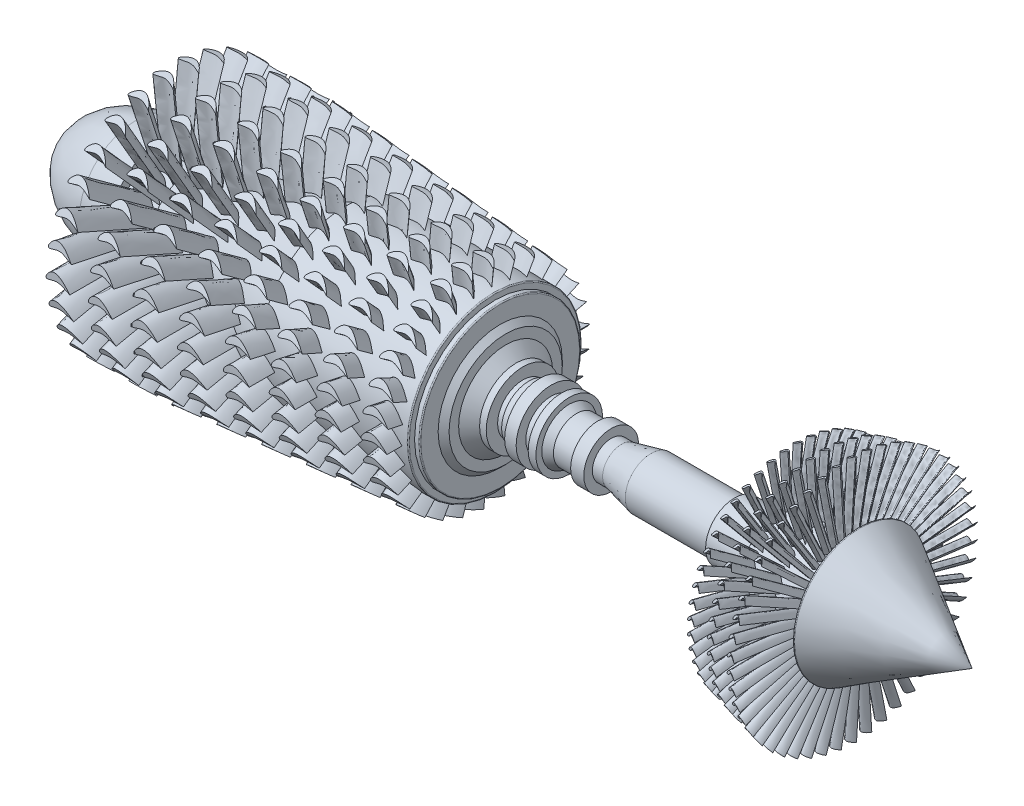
SolidWorks part; units mm, degrees
ref_plane "Front Plane" through (0, 0, 0) normal (0, 0, 1) x (1, 0, 0)
ref_plane "Top Plane" through (0, 0, 0) normal (0, 1, 0) x (1, 0, 0)
ref_plane "Right Plane" through (0, 0, 0) normal (1, 0, 0) x (0, 0, -1)
sketch "Sketch1" plane through (0, 0, 0) normal (0, 0, 1) x (1, 0, 0)
  line L0 (-311.1667, 12) -> (324.1667, 12) construction
sketch "Sketch3" plane through (0, 0, 0) normal (0, 0, 1) x (1, 0, 0)
  line L0 (-442.9556, 53.9612) -> (404.6867, 53.9612) construction
  line L1 (-442.9556, 0) -> (404.6867, 0) construction
  line L2 (-388.0448, 183.2391) -> (-243.6443, 183.2391) construction
  line L3 (-243.6443, 183.2391) -> (-129.9826, 173.946) construction
  line L4 (-129.9826, 173.946) -> (-45.3579, 163.3045) construction
  line L5 (-45.3579, 163.3045) -> (21.8151, 163.3045) construction
  line L6 (21.8151, 163.3045) -> (68.0956, 183.2391) construction
  line L7 (68.0956, 183.2391) -> (180.7178, 183.2391) construction
  line L8 (180.7178, 183.2391) -> (221.243, 163.3045) construction
  line L9 (221.243, 163.3045) -> (297.6355, 178.5926) construction
  line L10 (297.6355, 178.5926) -> (373.5398, 158.0965) construction
  line L11 (373.5398, 158.0965) -> (404.6867, 158.0965) construction
  line L12 (404.6867, 158.0965) -> (423.7959, 148.6966) construction
  line L13 (-388.0448, 183.2391) -> (-388.0448, 173.946) construction
  line L14 (-388.0448, 173.946) -> (-243.6443, 173.946) construction
  line L15 (-243.6443, 173.946) -> (-129.9826, 168.6253) construction
  line L16 (-129.9826, 168.6253) -> (-45.3579, 157.9838) construction
  line L17 (-45.3579, 157.9838) -> (21.8151, 157.9838) construction
  line L18 (21.8151, 157.9838) -> (68.0956, 177.9184) construction
  line L19 (68.0956, 177.9184) -> (180.7178, 177.9184) construction
  line L20 (180.7178, 177.9184) -> (219.1356, 159.0204) construction
  line L21 (219.1356, 159.0204) -> (297.6355, 174.7302) construction
  line L22 (297.6355, 174.7302) -> (373.5398, 154.2341) construction
  line L23 (373.5398, 154.2341) -> (404.6867, 154.2341) construction
  line L24 (404.6867, 154.2341) -> (422.2661, 145.5867) construction
  line L25 (422.2661, 145.5867) -> (423.7959, 148.6966) construction
  line L26 (404.6867, 53.9612) -> (297.6355, 116.8296)
  line L27 (297.6355, 116.8296) -> (297.6355, 104.3492)
  line L28 (297.6355, 104.3492) -> (232.7745, 104.3492)
  line L29 (232.7745, 104.3492) -> (232.7745, 92.3679)
  line L30 (232.7745, 92.3679) -> (229.2799, 92.3679)
  line L31 (229.2799, 92.3679) -> (229.2799, 81.3851)
  line L32 (229.2799, 81.3851) -> (180.7178, 81.3851)
  line L33 (180.7178, 81.3851) -> (180.7178, 78.1886)
  line L34 (180.7178, 78.1886) -> (101.7924, 78.1886)
  line L35 (101.7924, 78.1886) -> (73.814, 71.6783)
  line L36 (73.814, 71.6783) -> (64.2236, 71.6783)
  line L37 (64.2236, 71.6783) -> (64.2236, 79.7868)
  line L38 (64.2236, 79.7868) -> (51.7953, 79.7868)
  line L39 (51.7953, 79.7868) -> (51.7953, 75.7325)
  line L40 (51.7953, 75.7325) -> (31.5277, 75.7325)
  line L41 (31.5277, 75.7325) -> (24.6241, 79.7868)
  line L42 (24.6241, 79.7868) -> (24.6241, 85.3954)
  line L43 (24.6241, 85.3954) -> (17.3786, 85.3954)
  line L44 (17.3786, 85.3954) -> (17.3786, 77.7597)
  line L45 (17.3786, 77.7597) -> (7.4902, 77.7597)
  line L46 (7.4902, 77.7597) -> (7.4902, 86.8765)
  line L47 (7.4902, 86.8765) -> (-3.3761, 86.8765)
  line L48 (-3.3761, 86.8765) -> (-3.3761, 79.7868)
  line L49 (-3.3761, 79.7868) -> (-13.3475, 79.7868)
  line L50 (-13.3475, 79.7868) -> (-12.8758, 77.7597)
  line L51 (-12.8758, 77.7597) -> (-19.1344, 77.7597)
  line L52 (-19.1344, 77.7597) -> (-19.1344, 88.4726)
  line L53 (-19.1344, 88.4726) -> (-25.4181, 88.4726)
  line L54 (-25.4181, 88.4726) -> (-35.304, 98.3585)
  line L55 (-35.304, 98.3585) -> (-35.304, 107.3658)
  line L56 (-35.304, 107.3658) -> (-40.4636, 112.5254)
  line L57 (-40.4636, 112.5254) -> (-40.4636, 129.897)
  line L58 (-40.4636, 129.897) -> (-45.3579, 129.897)
  line L59 (-45.3579, 129.897) -> (-45.3579, 135.8224)
  line L60 (-45.3579, 135.8224) -> (-186.5964, 135.8224)
  line L61 (-186.5964, 135.8224) -> (-331.4751, 93.4156)
  line L62 (-331.4751, 93.4156) -> (-353.5356, 93.4156)
  line L63 (-353.5356, 93.4156) -> (-353.5356, 98.3585)
  line L64 (-353.5356, 98.3585) -> (-357.0938, 98.3585)
  line L65 (-357.0938, 98.3585) -> (-357.0938, 107.3658)
  line L66 (-357.0938, 107.3658) -> (-384.1357, 107.3658)
  line L67 (-450.0328, 53.9612) -> (404.6867, 53.9612)
  spline S0 degree 3 poles (-384.1357, 107.3658) (-413.6418, 105.6313) (-446.0016, 85.4922) (-450.0328, 53.9612) knots 0 0 0 0 1 1 1 1
revolve "Revolve1" add sketch "Sketch3" angle 360 about L0
sketch "Sketch4" plane through (0, 0, 0) normal (0, 0, 1) x (1, 0, 0)
  line L0 (-353.5356, 9.5639) -> (-353.5356, 98.3585) construction
  line L1 (-331.4751, 93.4156) -> (-331.4751, 14.5069) construction
  spline S0 degree 2 poles (-353.5356, 53.9612) (-345.8599, 67.0268) (-331.4751, 48.4677) knots 0 0 0 1 1 1
  spline S1 degree 3 poles (-353.5356, 53.9612) (-355.0894, 49.9866) (-343.1649, 54.4354) (-340.5936, 52.936) (-331.4751, 48.4677) knots 0 0 0 0 0.266975 1 1 1 1
extrude "Boss-Extrude1" add sketch "Sketch4" along normal blind 115
pattern_circular "CirPattern1" count 30 over 360 about axis through (-442.9556, 53.9612, 0) along (-1, 0, 0) of "Boss-Extrude1"
fillet "Fillet1" radius 1 1 edges at (297.6355, 53.9612, 62.8684)
fillet "Fillet2" radius 1 1 edges at (-45.3579, 53.9612, 81.8612)
fillet "Fillet3" radius 1 1 edges at (-40.4636, 53.9612, 75.9358)
pattern_linear "LPattern3" count 8 spacing 40 along (-1, 0, 0) of "Boss-Extrude1", "CirPattern1"
sketch "Sketch5" plane through (0, 0, 0) normal (0, 0, 1) x (1, 0, 0)
  line L0 (-273.5356, 168.3312) -> (-30.6625, 148.1886)
  line L1 (-30.6625, 148.1886) -> (-30.6625, 212.5276)
  line L2 (-30.6625, 212.5276) -> (-272.1952, 212.5276)
  line L3 (-272.1952, 212.5276) -> (-273.5356, 168.3312)
  line L4 (-384.1357, 53.9612) -> (-517.7004, 53.9612) construction
  line L5 (-384.1357, 107.3658) -> (-384.1357, 0.5567) construction
  line L6 (180.7178, 78.1886) -> (101.7924, 78.1886) construction
  dimension "D1" = 70
revolve "Cut-Revolve1" cut sketch "Sketch5" angle 360 about L4
sketch "Sketch6" plane through (0, 0, 0) normal (0, 0, 1) x (1, 0, 0)
  spline S0 degree 2 poles (236.6226, 48.2997) (240.1897, 55.6547) (245.2189, 46.2653) knots 0 0 0 1 1 1
  spline S1 degree 3 poles (236.6226, 48.2997) (235.6768, 46.9884) (240.8803, 46.3991) (239.4976, 53.7459) (245.2189, 46.2653) knots 0 0 0 0 0.223234 1 1 1 1
extrude "Boss-Extrude2" add sketch "Sketch6" along normal blind 115
pattern_circular "CirPattern2" count 50 over 360 about axis through (-442.9556, 53.9612, 0) along (-1, 0, 0) of "Boss-Extrude2"
pattern_linear "LPattern4" count 3 spacing 25 along (1, 0, 0) of "Boss-Extrude2", "CirPattern2"
sketch "Sketch7" plane through (0, 0, 0) normal (0, 0, 1) x (1, 0, 0)
  line L0 (295.2189, 169.2175) -> (229.9037, 152.7218)
  line L1 (229.9037, 152.7218) -> (229.9037, 182.6509)
  line L2 (229.9037, 182.6509) -> (295.2189, 184.9755)
  line L3 (295.2189, 184.9755) -> (295.2189, 169.2175)
  line L4 (180.7178, 53.9612) -> (566.1224, 53.9612) construction
  line L5 (180.7178, 78.1886) -> (180.7178, 29.7339) construction
revolve "Cut-Revolve2" cut sketch "Sketch7" angle 360 about L4
